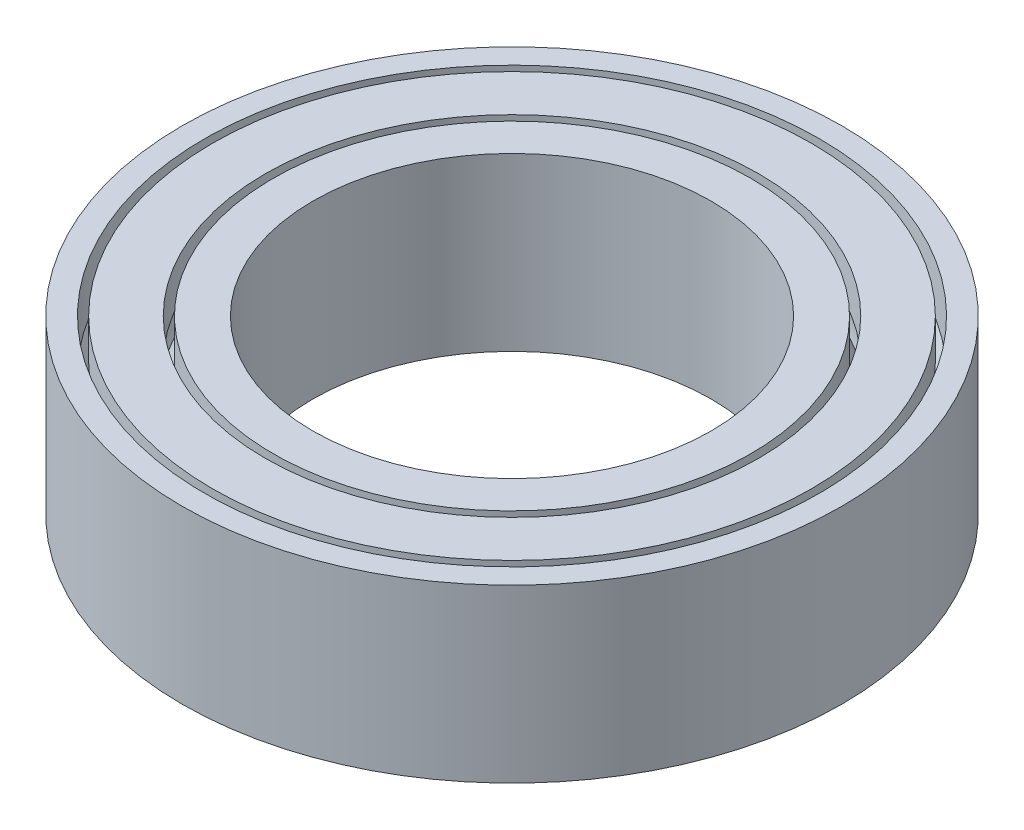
SolidWorks part; units mm, degrees
ref_plane "Front Plane" through (0, 0, 0) normal (0, 0, 1) x (1, 0, 0)
ref_plane "Top Plane" through (0, 0, 0) normal (0, 1, 0) x (1, 0, 0)
ref_plane "Right Plane" through (0, 0, 0) normal (1, 0, 0) x (0, 0, -1)
sketch "Sketch2" plane through (0, 0, 0) normal (0, 0, 1) x (1, 0, 0)
  line L0 (0, 0) -> (7.55, 0) construction
  line L1 (9.05, -1.3229) -> (9.05, -3.25)
  line L2 (7.55, 3.25) -> (9.05, 3.25)
  line L3 (7.55, 3.25) -> (7.55, -3.25)
  line L4 (7.55, -3.25) -> (9.05, -3.25)
  line L5 (9.05, 3.25) -> (9.05, 1.3229)
  line L6 (0, 0) -> (0, 6.7936) construction
  line L7 (7.55, 0) -> (11.6888, 0) construction
  line L8 (9.05, 1.3229) -> (9.05, -1.3229) construction
  arc A0 (9.05, -1.3229) -> (9.05, 1.3229) centre (7.55, 0) ccw
  dimension "D4" = 2
  dimension "D1" = 7.55
  dimension "D2" = 1.5
  dimension "D3" = 6.5
revolve "Revolve1" add sketch "Sketch2" angle 360 about L6
sketch "Sketch3" plane through (0, 0, 0) normal (0, 0, 1) x (1, 0, 0)
  line L5 (9.425, 1.6536) -> (9.35, 1.7386)
  line L6 (0, 0) -> (1.6845, 0) construction
  line L7 (9.35, -3.25) -> (9.35, -1.4318)
  line L8 (9.35, 1.4318) -> (9.35, 3.25)
  line L9 (9.35, -3.25) -> (9.35, -1.7386)
  line L10 (9.35, 1.7386) -> (9.35, 3.25)
  line L11 (9.425, -1.6536) -> (9.35, -1.7386)
  line L12 (9.35, 3.25) -> (11.35, 3.25)
  line L13 (10.35, 3.25) -> (10.35, -0.418) construction
  line L14 (11.275, -1.6536) -> (11.35, -1.7386)
  line L15 (11.35, 1.7386) -> (11.35, 3.25)
  line L16 (11.35, -3.25) -> (11.35, -1.7386)
  line L17 (11.275, 1.6536) -> (11.35, 1.7386)
  line L18 (9.35, -3.25) -> (11.35, -3.25)
  line L19 (0, 0) -> (0, 5.9618) construction
  arc A4 (9.35, -1.4318) -> (9.35, 1.4318) centre (7.55, 0) ccw
  arc A5 (11.275, -1.6536) -> (11.275, 1.6536) centre (13.15, 0) cw
  arc A7 (9.425, -1.6536) -> (9.425, 1.6536) centre (7.55, 0) ccw
  arc A8 (9.425, -1.6536) -> (9.425, 1.6536) centre (7.55, 0) ccw
  dimension "D3" = 2
  dimension "D1" = 0.3
  dimension "D2" = 0.5
revolve "Revolve3" add sketch "Sketch3" angle 360 about L19
sketch "Sketch5" plane through (0, 0, 0) normal (0, 0, 1) x (1, 0, 0)
  line L0 (11.65, 1.3229) -> (11.65, 3.25)
  line L2 (0, 0) -> (0, 5.8078) construction
  line L10 (11.65, -3.25) -> (12.5, -3.25)
  line L11 (12.5, -3.25) -> (12.5, 3.25)
  line L12 (12.5, 3.25) -> (11.65, 3.25)
  line L14 (-11.35, -3.25) -> (11.35, -3.25) construction
  line L15 (11.35, 3.25) -> (-11.35, 3.25) construction
  line L16 (11.65, -1.3229) -> (11.65, -3.25)
  arc A6 (11.65, 1.3229) -> (11.65, -1.3229) centre (13.15, 0) ccw
  arc A7 (11.65, 1.3229) -> (11.65, -1.3229) centre (13.15, 0) ccw
  dimension "D3" = 12.5
  dimension "D1" = 0.5
revolve "Revolve4" add sketch "Sketch5" angle 360 about L2
